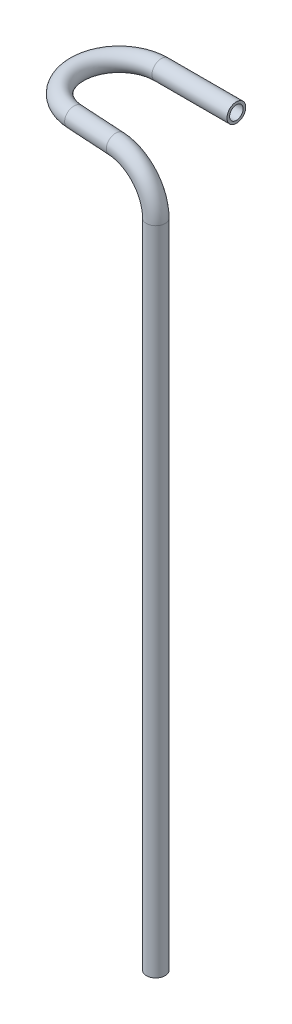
SolidWorks part; units mm, degrees
ref_plane "Front" through (0, 0, 0) normal (0, 0, 1) x (1, 0, 0)
ref_plane "Top" through (0, 0, 0) normal (0, 1, 0) x (1, 0, 0)
ref_plane "Right" through (0, 0, 0) normal (1, 0, 0) x (0, 0, -1)
sketch3d "3DSketch1"
  line L0 (0, 0, 0) -> (-25.4, 0, 0)
  line L1 (-26.2536, 0, 28.5495) -> (-11.2394, 0, 29.4481)
  line L2 (3.0226, -14.2875, 30.3017) -> (3.0226, -234.95, 30.3017)
  arc A0 (-25.4, 0, 0) -> (-26.2536, 0, 28.5495) centre (-25.4, 0, 14.2875) ccw
  arc A1 (-11.2394, 0, 29.4481) -> (3.0226, -14.2875, 30.3017) centre (-11.2394, -14.2875, 29.4481) ccw
  circle A2 centre (3.0226, -223.8695, 30.3017) radius 3.175 construction
  point P4 (-25.4, 14.2875, 14.2875)
  point P11 (3.0226, 0, 30.3017)
  point P12 (-10.3858, -14.2875, 15.1861)
  point P15 (3.0226, -227.0445, 30.3017)
  dimension "D1" = 25.4
  dimension "D2" = 14.2875
  dimension "D5" = 14.2875
  dimension "D3" = 234.95
  dimension "D4" = 3.425
  dimension "D6" = 15.0411
sketch "Sketch1" plane through (0, 0, 0) normal (1, 0, 0) x (0, 0, -1)
  circle A0 centre (0, 0) radius 3.175
  circle A1 centre (0, 0) radius 2.286
  dimension "D1" = 0.889
  dimension "D2" = 6.35
sweep "Sweep1" add profiles "Sketch1" path "3DSketch1"
